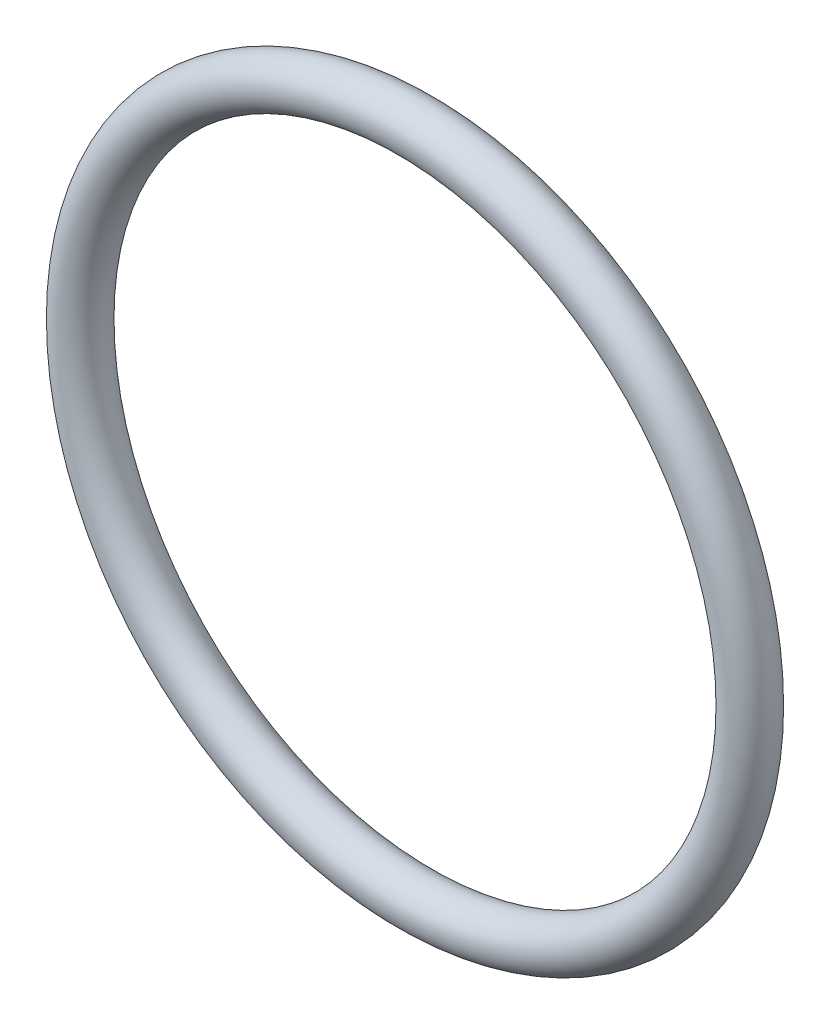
SolidWorks part; units mm, degrees
ref_plane "Ebene vorne" through (0, 0, 0) normal (0, 0, 1) x (1, 0, 0)
ref_plane "Ebene oben" through (0, 0, 0) normal (0, 1, 0) x (1, 0, 0)
ref_plane "Ebene rechts" through (0, 0, 0) normal (1, 0, 0) x (0, 0, -1)
sketch "Skizze1" plane through (0, 0, 0) normal (1, 0, 0) x (0, 0, -1)
  line L0 (0, 0) -> (63.9124, 0) construction
  line L1 (0, 0) -> (0, 13) construction
  line L2 (0, 14) -> (0, 13) construction
  circle A0 centre (0, 14) radius 1
  dimension "D1" = 2
  dimension "D2" = 13
revolve "Rotation1" add sketch "Skizze1" angle 360 about L0
